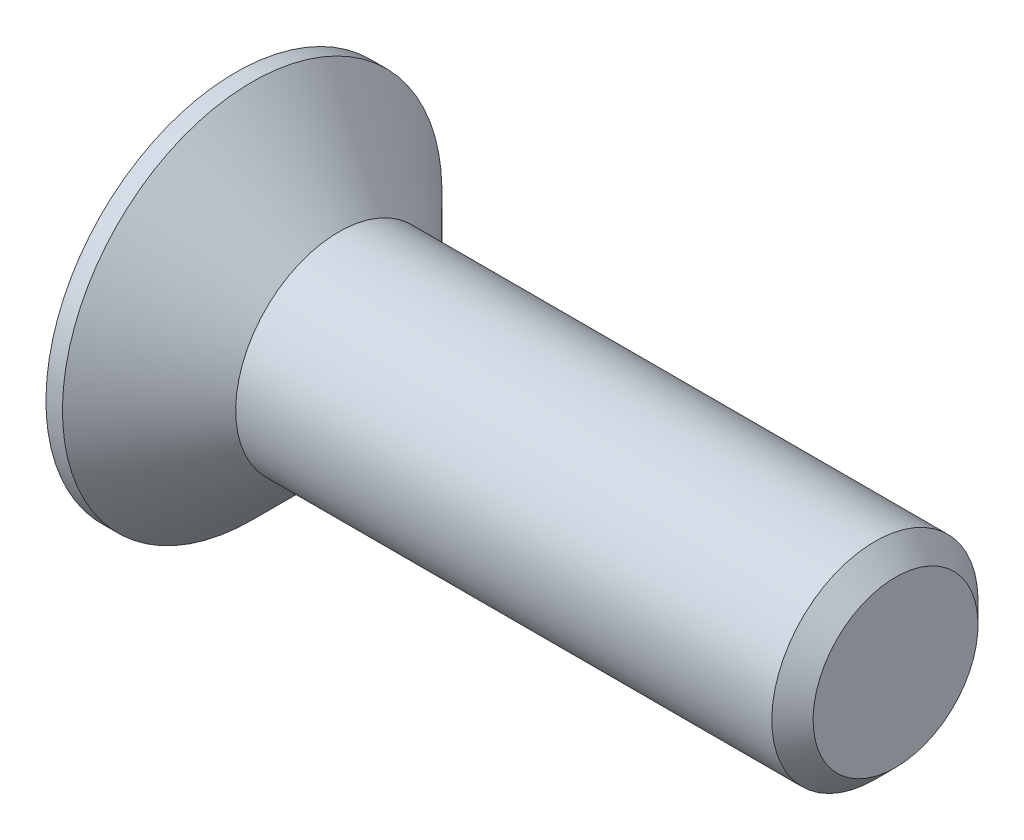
SolidWorks part; units mm, degrees
ref_plane "Front Plane" through (0, 0, 0) normal (0, 0, 1) x (1, 0, 0)
ref_plane "Top Plane" through (0, 0, 0) normal (0, 1, 0) x (1, 0, 0)
ref_plane "Right Plane" through (0, 0, 0) normal (1, 0, 0) x (0, 0, -1)
sketch "Sketch1" plane through (0, 0, 0) normal (0, 0, 1) x (1, 0, 0)
  line L1 (-2.5, 4.6) -> (-2.5, 0)
  line L2 (-2.5, 0) -> (13.5, 0)
  line L3 (13.5, 0) -> (13.5, 2.5)
  line L4 (13.5, 2.5) -> (0, 2.5)
  line L5 (-2.5, 4.6) -> (-2.1, 4.6)
  line L6 (-2.1, 4.6) -> (0, 2.5)
  dimension "D1" = 2.5
  dimension "D2" = 45
  dimension "D3" = 2.5
  dimension "D4" = 16
  dimension "D5" = 4.6
revolve "Revolve1" add sketch "Sketch1" angle 360 about L2
chamfer "Chamfer1" distance 0.5 angle 45 1 edges at (13.5, -2.5, 0)
sketch "Sketch2" plane through (-2.5, 0, 0) normal (-1, 0, 0) x (0, 0, 1)
  line L0 (-0.575, 2.3) -> (0.575, 2.3)
  line L1 (0.575, 2.3) -> (0.575, 0.575)
  line L2 (0.575, 0.575) -> (2.3, 0.575)
  line L3 (2.3, 0.575) -> (2.3, -0.575)
  line L4 (2.3, -0.575) -> (0.575, -0.575)
  line L5 (0.575, -0.575) -> (0.575, -2.3)
  line L6 (0.575, -2.3) -> (-0.575, -2.3)
  line L7 (-0.575, -2.3) -> (-0.575, -0.575)
  line L8 (-0.575, -0.575) -> (-2.3, -0.575)
  line L9 (-2.3, -0.575) -> (-2.3, 0.575)
  line L10 (-2.3, 0.575) -> (-0.575, 0.575)
  line L11 (-0.575, 0.575) -> (-0.575, 2.3)
  point P2 (0, 2.3)
  point P14 (0, -2.3)
  point P15 (2.3, 0)
  point P16 (-2.3, 0)
  dimension "D1" = 4.6
  dimension "D2" = 1.15
extrude "Cut-Extrude1" cut sketch "Sketch2" against normal blind 2.1
